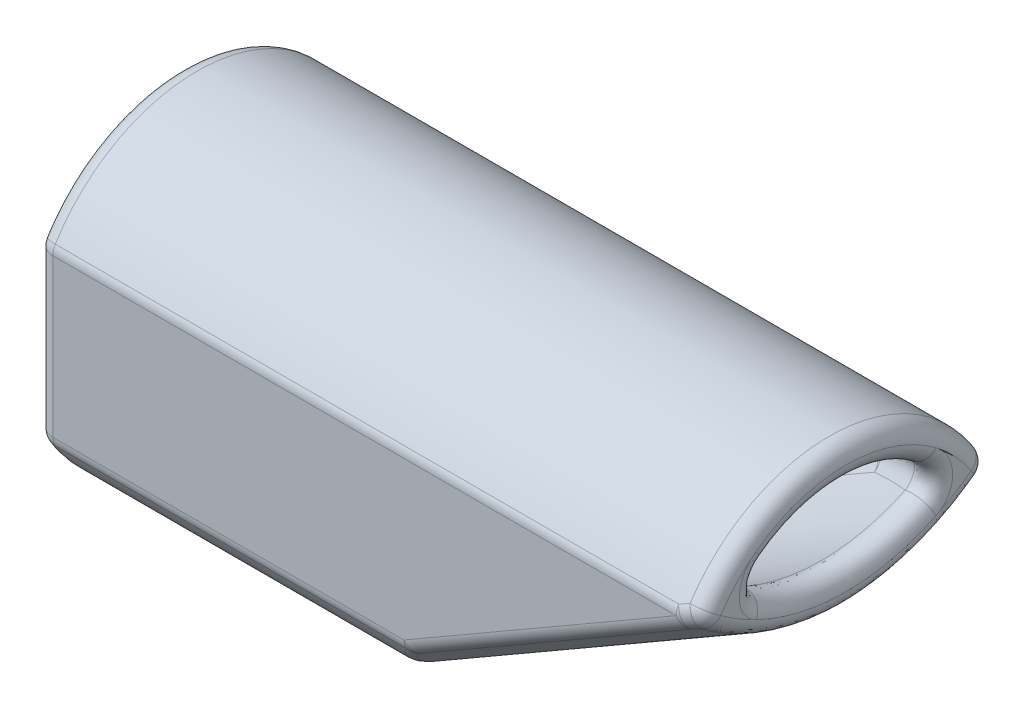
SolidWorks part; units mm, degrees
ref_plane "Front Plane" through (0, 0, 0) normal (0, 0, 1) x (1, 0, 0)
ref_plane "Top Plane" through (0, 0, 0) normal (0, 1, 0) x (1, 0, 0)
ref_plane "Right Plane" through (0, 0, 0) normal (1, 0, 0) x (0, 0, -1)
sketch "Sketch1" plane through (0, 0, 0) normal (1, 0, 0) x (0, 0, -1)
  circle A0 centre (0, 0) radius 12.7
  dimension "D1" = 25.4
extrude "Extrude1" add sketch "Sketch1" along normal blind 50.8
sketch "Sketch2" plane through (50.8, 0, 0) normal (1, 0, 0) x (0, 0, -1)
  line L0 (-10.9985, 6.35) -> (10.9985, 6.35) construction
  circle A0 centre (0, 0) radius 12.7 construction
  dimension "D1" = 6.35
ref_plane "Plane1" through (40.8496, 23.5845, 0) normal (-0.866, -0.5, 0) x (0.5, -0.866, 0)
sketch "Sketch5" plane through (40.8496, 23.5845, 0) normal (-0.866, -0.5, 0) x (0.5, -0.866, 0)
  line L0 (3.7102, 19.0394) -> (-38.9668, 17.6131)
  line L1 (-38.9668, 17.6131) -> (-37.8256, -16.5347)
  line L2 (-37.8256, -16.5347) -> (13.8072, -16.5347)
  arc A0 (3.7102, 19.0394) -> (13.8072, -16.5347) centre (4.3465, 0) cw
  dimension "D1" = 19.05
extrude "Extrude5" cut sketch "Sketch5" along normal blind 76.2 flip side to cut
sketch "Sketch6" plane through (0, 0, 0) normal (1, 0, 0) x (0, 0, -1)
  line L0 (-10.9985, 6.35) -> (-10.9985, -15.3284)
  line L1 (-10.9985, -15.3284) -> (10.9985, -15.3284)
  line L2 (10.9985, -15.3284) -> (10.9985, 19.7211)
  line L3 (10.9985, 19.7211) -> (-10.9985, 19.7211)
  line L4 (-10.9985, 19.7211) -> (-10.9985, 6.35)
extrude "Extrude6" cut sketch "Sketch6" along normal through all flip side to cut
shell "Shell3" thickness 2.54
fillet "Fillet3" radius 1.27 28 edges at (39.8015, 0, -10.9985) (24.8223, -12.6342, -1.2909) (39.8015, 0, 10.9985) (50.8, 2.3135, 0) (37.0502, 0, 8.4585) (25.4, 6.35, 10.9985) (14.4015, -6.35, 10.9985) (14.4015, -6.35, -10.9985) (25.4, 6.35, -10.9985) (50.8, 5.2464, 0) (50.8, 10.16, 0) (50.8, 12.7, 0) (0, -12.7, 0) (0, 12.7, 0) (0, 0, -10.9985) (0, 0, 10.9985) (0, -10.16, 0) (0, 10.16, 0) (24.1429, -10.1051, -1.0545) (0, 0, 8.4585) (13.6508, -5.6284, 8.4585) (23.3995, 5.6284, 8.4585) (23.3995, 5.6284, -8.4585) (13.6508, -5.6284, -8.4585) (0, 0, -8.4585) (37.0502, 0, -8.4585)
